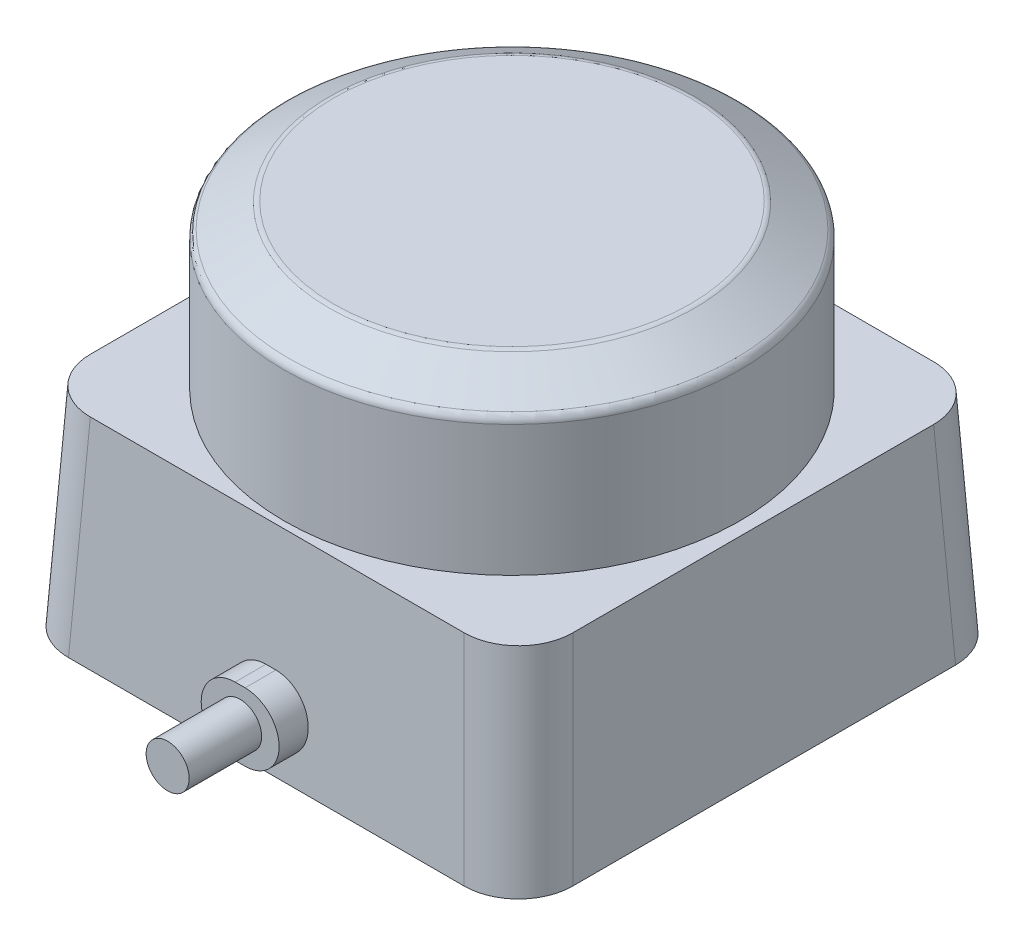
SolidWorks part; units mm, degrees
ref_plane "Front Plane" through (0, 0, 0) normal (0, 0, 1) x (1, 0, 0)
ref_plane "Top Plane" through (0, 0, 0) normal (0, 1, 0) x (1, 0, 0)
ref_plane "Right Plane" through (0, 0, 0) normal (1, 0, 0) x (0, 0, -1)
sketch "Sketch1" plane through (0, 0, 0) normal (0, 1, 0) x (1, 0, 0)
  line L1 (27.825, -27.1103) -> (-27.825, -27.1103)
  line L2 (27.825, -27.1103) -> (27.825, 27.1103)
  line L3 (27.825, 27.1103) -> (-27.825, 27.1103)
  line L4 (-27.825, -27.1103) -> (-27.825, 27.1103)
  line L5 (27.825, -27.1103) -> (-27.825, 27.1103) construction
  line L6 (27.825, 27.1103) -> (-27.825, -27.1103) construction
  point P0 (0, 0)
  dimension "D1" = 55.65
extrude "Boss-Extrude1" add sketch "Sketch1" along normal blind 23 draft 3
sketch "Sketch2" plane through (0, 23, 0) normal (0, 1, 0) x (1, 0, 0)
  circle A0 centre (0, 0) radius 25.15
  dimension "D1" = 50.3
extrude "Boss-Extrude2" add sketch "Sketch2" along normal blind 18
chamfer "Chamfer1" distance 3 angle 60 1 edges at (0, 41, 25.15)
sketch "Sketch3" plane through (0, 0, 0) normal (0, 0, 1) x (1, 0, 0)
  line L0 (0.55, 6) -> (-0.55, 6) construction
  line L1 (0.55, 2.25) -> (-0.55, 2.25)
  line L2 (0.55, 9.75) -> (-0.55, 9.75)
  line L3 (-27.825, 0) -> (27.825, 0) construction
  arc A0 (0.55, 2.25) -> (0.55, 9.75) centre (0.55, 6) ccw
  arc A1 (-0.55, 9.75) -> (-0.55, 2.25) centre (-0.55, 6) ccw
  point P2 (0, 6)
  point P7 (0, 0)
  dimension "D1" = 7.5
  dimension "D2" = 1.1
  dimension "D3" = 6
extrude "Boss-Extrude3" add sketch "Sketch3" along normal blind 30
sketch "Sketch4" plane through (0, 0, 30) normal (0, 0, 1) x (1, 0, 0)
  circle A0 centre (0, 6) radius 2.375
  dimension "D1" = 4.75
extrude "Boss-Extrude4" add sketch "Sketch4" along normal blind 8
sketch "Sketch5" plane through (0, 0, 0) normal (0, -1, 0) x (1, 0, 0)
  line L1 (21.4, -21.4) -> (-21.4, -21.4) construction
  line L2 (21.4, -21.4) -> (21.4, 21.4) construction
  line L3 (21.4, 21.4) -> (-21.4, 21.4) construction
  line L4 (-21.4, -21.4) -> (-21.4, 21.4) construction
  line L5 (21.4, -21.4) -> (-21.4, 21.4) construction
  line L6 (21.4, 21.4) -> (-21.4, -21.4) construction
  circle A0 centre (-21.4, 21.4) radius 1.25
  circle A1 centre (21.4, 21.4) radius 1.25
  circle A2 centre (21.4, -21.4) radius 1.25
  circle A3 centre (-21.4, -21.4) radius 1.25
  point P0 (0, 0)
  dimension "D1" = 2.5
  dimension "D2" = 42.8
extrude "Cut-Extrude1" cut sketch "Sketch5" against normal blind 5
chamfer "Chamfer2" distance 0.2 angle 60 4 edges at (-21.4, 0, 20.15) (21.4, 0, -22.65) (-21.4, 0, -22.65) (21.4, 0, 20.15)
fillet "Fillet1" radius 6 4 edges at (-27.2223, 11.5, 26.5076) (-27.2223, 11.5, -26.5076) (27.2223, 11.5, -26.5076) (27.2223, 11.5, 26.5076)
fillet "Fillet2" radius 1 2 edges at (0, 41, 19.9538) (0, 38, 25.15)
